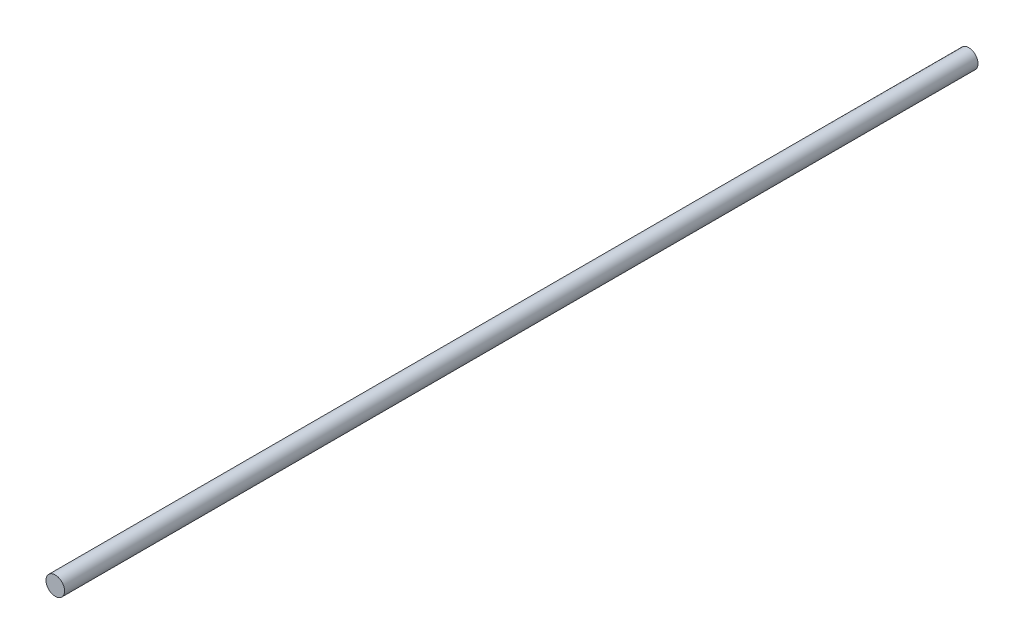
SolidWorks part; units mm, degrees
ref_plane "Front Plane" through (0, 0, 0) normal (0, 0, 1) x (1, 0, 0)
ref_plane "Top Plane" through (0, 0, 0) normal (0, 1, 0) x (1, 0, 0)
ref_plane "Right Plane" through (0, 0, 0) normal (1, 0, 0) x (0, 0, -1)
sketch "Sketch1" plane through (0, 0, 0) normal (0, 0, 1) x (1, 0, 0)
  circle A0 centre (0, 0) radius 30
  dimension "D1" = 60
extrude "Boss-Extrude1" add sketch "Sketch1" against normal blind 2950
